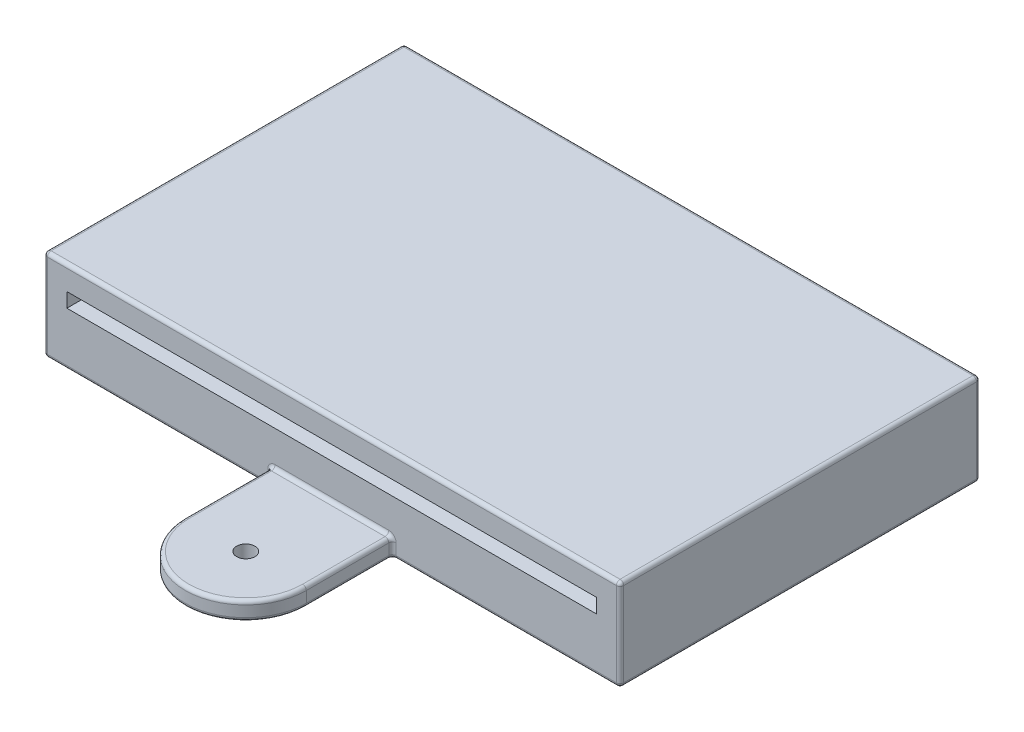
SolidWorks part; units mm, degrees
ref_plane "Front Plane" through (0, 0, 0) normal (0, 0, 1) x (1, 0, 0)
ref_plane "Top Plane" through (0, 0, 0) normal (0, 1, 0) x (1, 0, 0)
ref_plane "Right Plane" through (0, 0, 0) normal (1, 0, 0) x (0, 0, -1)
sketch "Sketch1" plane through (0, 0, 0) normal (0, 1, 0) x (1, 0, 0)
  line L0 (-400, -250) -> (400, 250) construction
  line L1 (-400, -250) -> (400, -250)
  line L2 (-400, -250) -> (-400, 250)
  line L3 (-400, 250) -> (400, 250)
  line L4 (400, -250) -> (400, 250)
  dimension "D1" = 800
  dimension "D2" = 500
extrude "Extrude1" add sketch "Sketch1" along normal blind 127
sketch "Sketch2" plane through (0, 0, 0) normal (0, -1, 0) x (1, 0, 0)
  line L0 (-83.9969, 250) -> (-83.9969, 369.634)
  line L1 (-400, 250) -> (400, 250) construction
  line L2 (83.9969, 369.634) -> (83.9969, 250)
  line L3 (-83.9969, 250) -> (83.9969, 250)
  line L4 (0, 369.634) -> (0, 0) construction
  arc A0 (-83.9969, 369.634) -> (83.9969, 369.634) centre (0, 369.634) cw
  dimension "D1" = 119.634
extrude "Extrude2" add sketch "Sketch2" against normal blind 25.4
sketch "Sketch3" plane through (0, 0, 0) normal (0, -1, 0) x (1, 0, 0)
  circle A0 centre (0, 369.634) radius 12.7
  circle A1 centre (0, 369.634) radius 12.7 construction
extrude "Cut-Extrude1" cut sketch "Sketch3" against normal through all
sketch "Sketch4" plane through (0, 0, 250) normal (0, 0, 1) x (1, 0, 0)
  line L0 (-400, 127) -> (-400, 0) construction
  line L1 (-368, 94) -> (367, 94)
  line L2 (-368, 94) -> (-368, 74)
  line L3 (-368, 74) -> (367, 74)
  line L4 (367, 94) -> (367, 74)
  line L5 (400, 127) -> (400, 0) construction
  line L6 (-400, 127) -> (400, 127) construction
  dimension "D1" = 32
  dimension "D2" = 33
  dimension "D3" = 20
  dimension "D4" = 33
extrude "Cut-Extrude2" cut sketch "Sketch4" against normal blind 76.2
fillet "Fillet1" radius 5.08 23 edges at (400, 127, 0) (0, 127, -250) (0, 25.4, 250) (-83.9969, 25.4, 309.817) (0, 25.4, 453.6309) (83.9969, 25.4, 309.817) (0, 0, 453.6309) (0, 0, 356.934) (-400, 127, 0) (0, 0, -250) (400, 0, 0) (-400, 0, 0) (0, 127, 250) (-400, 63.5, -250) (400, 63.5, -250) (400, 63.5, 250) (-400, 63.5, 250)
